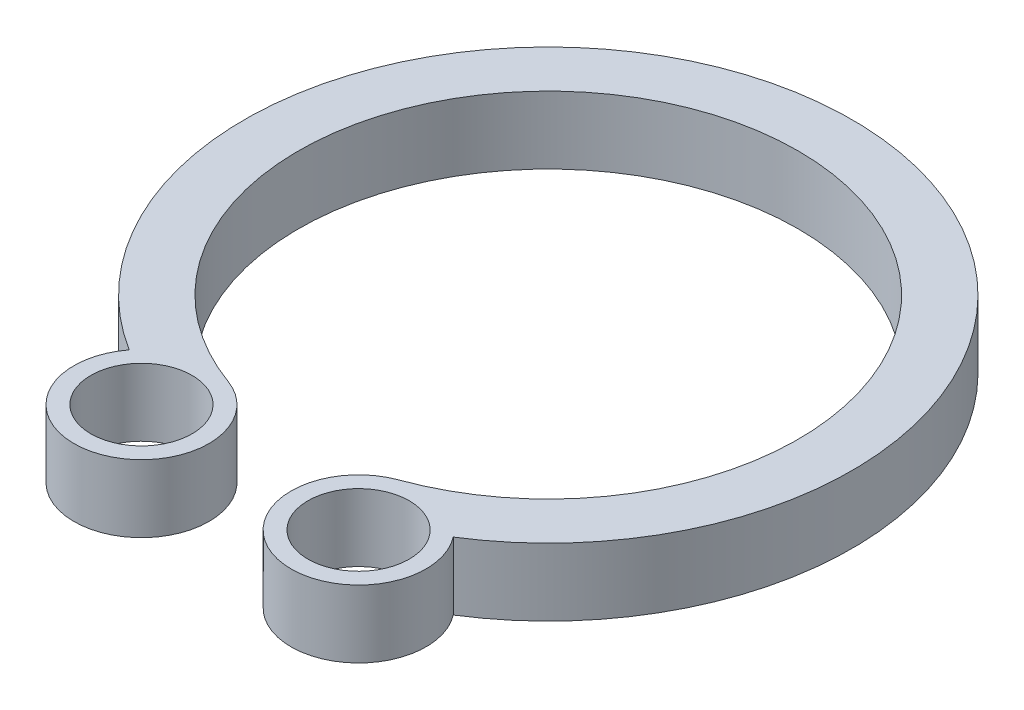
SolidWorks part; units mm, degrees
ref_plane "Спереди" through (0, 0, 0) normal (0, 0, 1) x (1, 0, 0)
ref_plane "Сверху" through (0, 0, 0) normal (0, 1, 0) x (1, 0, 0)
ref_plane "Справа" through (0, 0, 0) normal (1, 0, 0) x (0, 0, -1)
sketch "Эскиз1" plane through (0, 0, 0) normal (0, 1, 0) x (1, 0, 0)
  line L0 (0, 0) -> (0, -11.4621) construction
  line L1 (0, 0) -> (3.8497, -10.5769) construction
  line L2 (0.6156, 1.6914) -> (-2.7021, -7.424) construction
  arc A0 (2.3999, -3.8066) -> (-2.3999, -3.8066) centre (0, 0) ccw
  arc A1 (1.2655, -3.4769) -> (-1.2655, -3.4769) centre (0, 0) ccw
  arc A2 (-2.3999, -3.8066) -> (-1.2655, -3.4769) centre (-1.6075, -4.4166) ccw
  arc A3 (1.2655, -3.4769) -> (2.3999, -3.8066) centre (1.6075, -4.4166) ccw
  circle A4 centre (-1.6075, -4.4166) radius 0.75
  circle A5 centre (1.6075, -4.4166) radius 0.75
  dimension "D1" = 9
  dimension "D2" = 7.4
  dimension "D3" = 1.5
  dimension "D4" = 1
extrude "Бобышка-Вытянуть1" add sketch "Эскиз1" along normal blind 1
